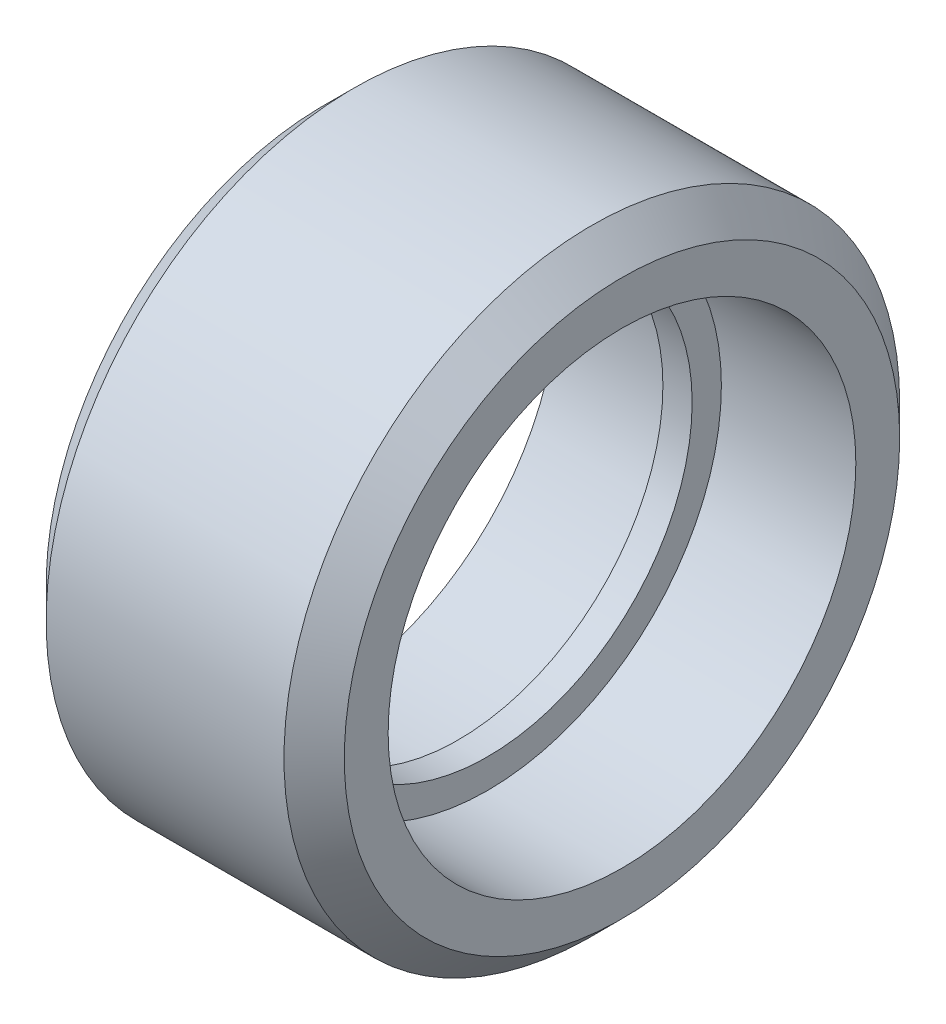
SolidWorks part; units mm, degrees
ref_plane "Front Plane" through (0, 0, 0) normal (0, 0, 1) x (1, 0, 0)
ref_plane "Top Plane" through (0, 0, 0) normal (0, 1, 0) x (1, 0, 0)
ref_plane "Right Plane" through (0, 0, 0) normal (1, 0, 0) x (0, 0, -1)
sketch "Sketch1" plane through (0, 0, 0) normal (0, 0, 1) x (1, 0, 0)
  line L0 (0, 0) -> (0, 8) construction
  line L1 (0, -55) -> (0, 55) construction
  line L2 (0, 7) -> (-0.5, 7)
  line L3 (-0.5, 7) -> (-0.5, 8)
  line L4 (-0.5, 8) -> (-5.1, 8)
  line L5 (-5.1, 8) -> (-5.1, 9.5)
  line L6 (-5.1, 9.5) -> (-4.0686, 10.5314)
  line L7 (-4.0686, 10.5314) -> (0, 10.5314)
  line L8 (0, 10.5314) -> (0, 7)
  line L9 (55, 0) -> (-55, 0) construction
  line L10 (0, 0) -> (-8.8433, 0) construction
  point P5 (0, 7)
  dimension "D1" = 7
  dimension "D2" = 5.1
  dimension "D3" = 4.0686
  dimension "D4" = 45
  dimension "D5" = 8
revolve "Revolve1" add sketch "Sketch1" angle 360 about L10
mirror "Mirror1" about plane through (0, 10.5314, 0) normal (1, 0, 0) of "Revolve1"
